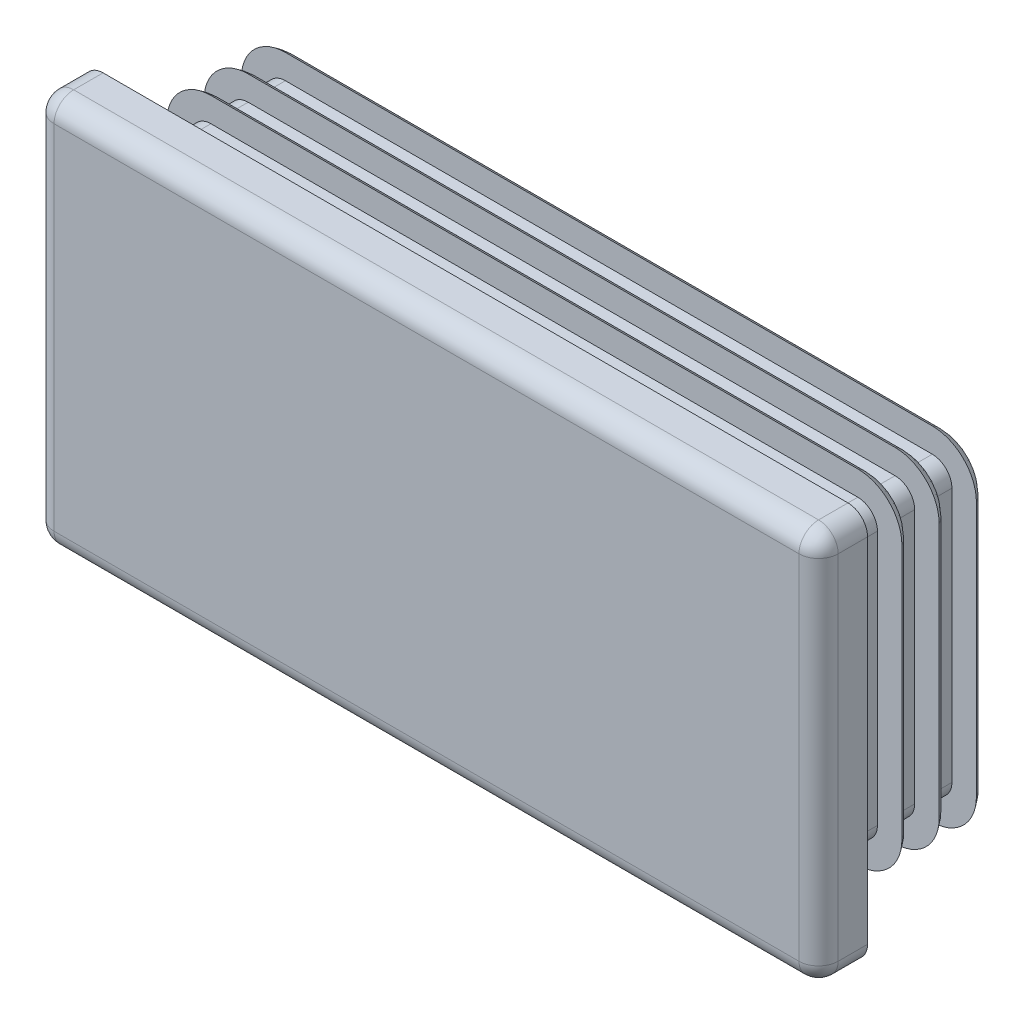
SolidWorks part; units mm, degrees
ref_plane "Plan de face" through (0, 0, 0) normal (0, 0, 1) x (1, 0, 0)
ref_plane "Plan de dessus" through (0, 0, 0) normal (0, 1, 0) x (1, 0, 0)
ref_plane "Plan de droite" through (0, 0, 0) normal (1, 0, 0) x (0, 0, -1)
imported_body "Importée1"
other "Répétition linéaire1"
